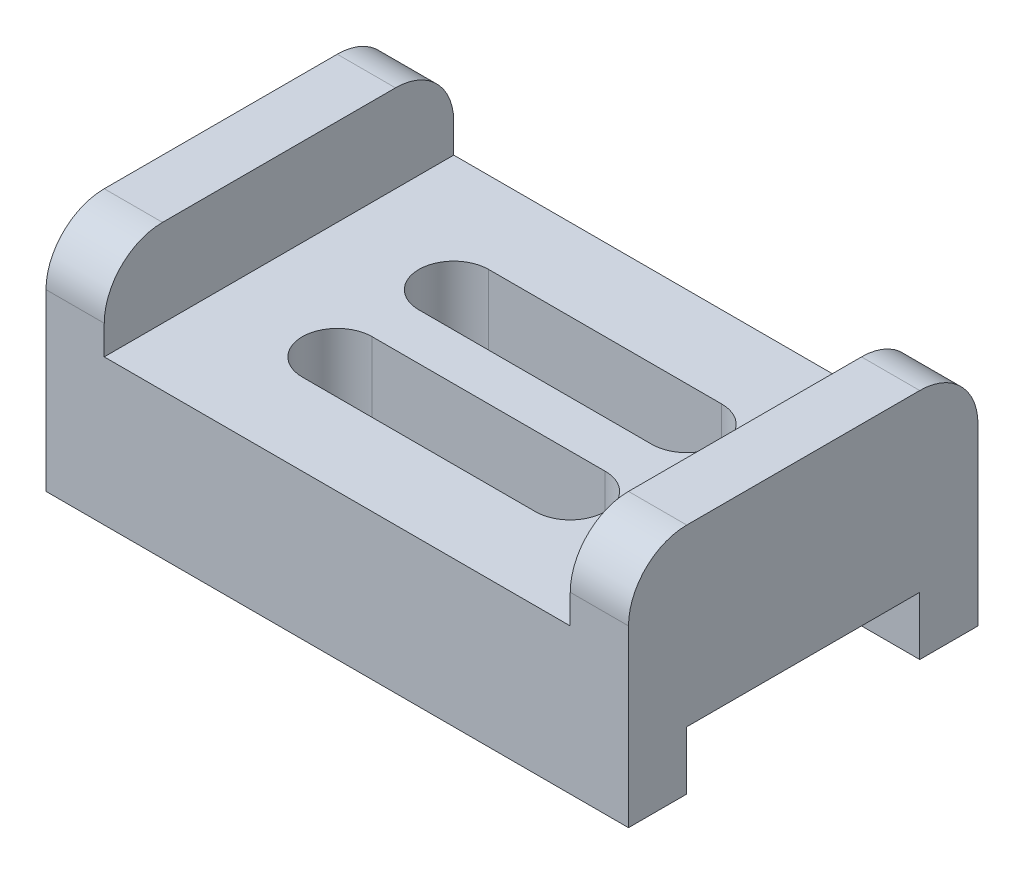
SolidWorks part; units mm, degrees
ref_plane "正面" through (0, 0, 0) normal (0, 0, 1) x (1, 0, 0)
ref_plane "平面" through (0, 0, 0) normal (0, 1, 0) x (1, 0, 0)
ref_plane "右側面" through (0, 0, 0) normal (1, 0, 0) x (0, 0, -1)
sketch "ｽｹｯﾁ1" plane through (0, 0, 0) normal (0, 1, 0) x (1, 0, 0)
  line L1 (0, 0) -> (-100, 0)
  line L2 (0, 0) -> (0, 60)
  line L3 (0, 60) -> (-100, 60)
  line L4 (-100, 0) -> (-100, 60)
  dimension "D1" = 60
  dimension "D2" = 100
extrude "押し出し1" add sketch "ｽｹｯﾁ1" along normal blind 40
sketch "ｽｹｯﾁ2" plane through (0, 0, 0) normal (1, 0, 0) x (0, 0, -1)
  line L0 (30, 40) -> (30, 0) construction
  line L1 (0, 40) -> (60, 40) construction
  line L2 (0, 0) -> (60, 0) construction
  line L4 (10, 10) -> (50, 10)
  line L5 (10, 10) -> (10, 0)
  line L6 (10, 0) -> (50, 0)
  line L7 (50, 10) -> (50, 0)
  dimension "D1" = 40
  dimension "D2" = 10
extrude "ｶｯﾄ - 押し出し1" cut sketch "ｽｹｯﾁ2" against normal through all
sketch "ｽｹｯﾁ3" plane through (0, 40, 0) normal (0, 1, 0) x (1, 0, 0)
  line L0 (0, 60) -> (-100, 60) construction
  line L1 (-90, 60) -> (-10, 60)
  line L2 (-90, 60) -> (-90, 0)
  line L3 (-90, 0) -> (-10, 0)
  line L4 (-10, 60) -> (-10, 0)
  line L5 (-100, 0) -> (0, 0) construction
  line L6 (0, 0) -> (0, 60) construction
  dimension "D1" = 80
  dimension "D2" = 10
extrude "ｶｯﾄ - 押し出し2" cut sketch "ｽｹｯﾁ3" against normal offset from surface (15 mm away) 25
sketch "ｽｹｯﾁ4" plane through (0, 25, 0) normal (0, 1, 0) x (1, 0, 0)
  line L0 (-90, 30) -> (-10, 30) construction
  line L1 (-90, 0) -> (-90, 60) construction
  line L2 (-10, 60) -> (-10, 0) construction
  line L3 (0, 0) -> (0, 60) construction
  line L4 (-70, 40) -> (-30, 40) construction
  line L5 (-70, 40) -> (-70, 20) construction
  line L6 (-70, 20) -> (-30, 20) construction
  line L7 (-30, 40) -> (-30, 20) construction
  line L10 (-70, 46) -> (-30, 46)
  line L11 (-70, 34) -> (-30, 34)
  line L12 (-70, 26) -> (-30, 26)
  line L13 (-70, 14) -> (-30, 14)
  arc A0 (-70, 26) -> (-70, 14) centre (-70, 20) ccw
  arc A1 (-70, 46) -> (-70, 34) centre (-70, 40) ccw
  arc A2 (-30, 34) -> (-30, 46) centre (-30, 40) ccw
  arc A3 (-30, 14) -> (-30, 26) centre (-30, 20) ccw
  dimension "D1" = 20
  dimension "D4" = 30
  dimension "D2" = 12
  dimension "D3" = 40
extrude "ｶｯﾄ - 押し出し3" cut sketch "ｽｹｯﾁ4" against normal through all
fillet "ﾌｨﾚｯﾄ1" radius 10 4 edges at (-5, 40, 0) (-5, 40, -60) (-95, 40, -60) (-95, 40, 0)
